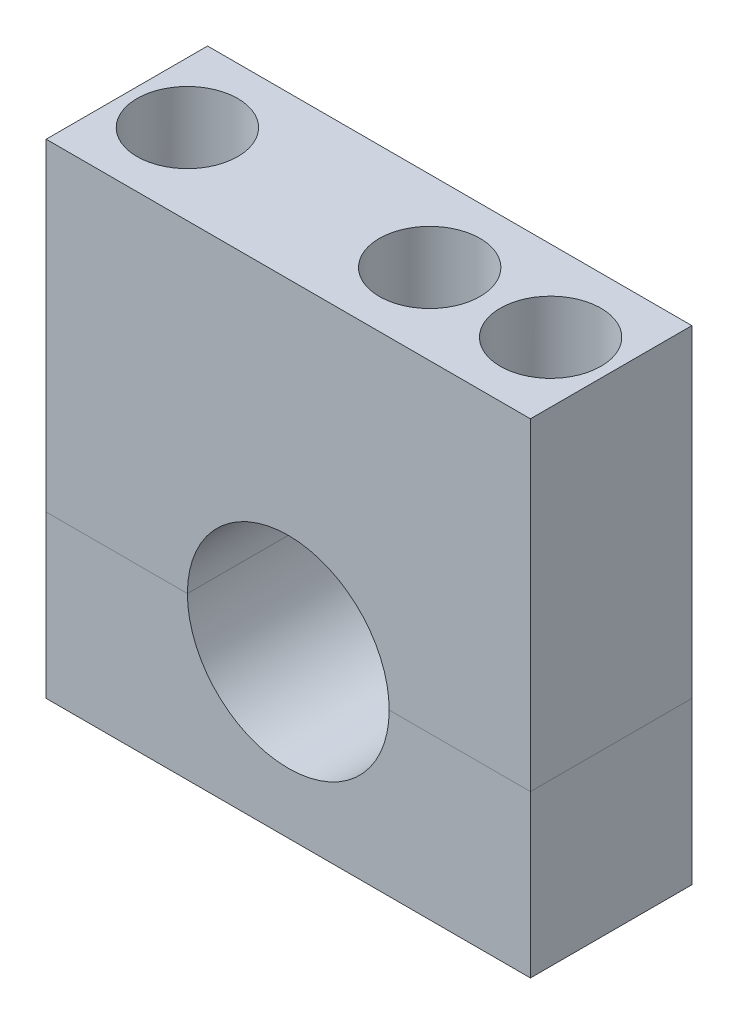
SolidWorks part; units mm, degrees
ref_plane "Front Plane" through (0, 0, 0) normal (0, 0, 1) x (1, 0, 0)
ref_plane "Top Plane" through (0, 0, 0) normal (0, 1, 0) x (1, 0, 0)
ref_plane "Right Plane" through (0, 0, 0) normal (1, 0, 0) x (0, 0, -1)
sketch "Sketch1" plane through (0, 0, 0) normal (0, 0, 1) x (1, 0, 0)
  line L0 (0, 0) -> (7.9375, 0) construction
  line L1 (0, 0) -> (0, 7.9375) construction
  line L2 (7.9375, 0) -> (19.05, 0)
  line L3 (19.05, 0) -> (19.05, 25.4)
  line L4 (19.05, 25.4) -> (-19.05, 25.4)
  line L5 (-19.05, 25.4) -> (-19.05, 0)
  line L6 (-19.05, 0) -> (-7.9375, 0)
  line L7 (19.05, 0) -> (19.05, -12.7)
  line L8 (19.05, -12.7) -> (-19.05, -12.7)
  line L9 (-19.05, -12.7) -> (-19.05, 0)
  line L10 (-14.2875, 25.4) -> (-14.2875, 0)
  line L11 (14.2875, 25.4) -> (14.2875, 0)
  line L12 (4.7752, 25.4) -> (4.7752, 16.4499) construction
  circle A0 centre (0, 0) radius 7.9375
  dimension "D1" = 15.875
  dimension "D2" = 38.1
  dimension "D4" = 25.4
  dimension "D5" = 12.7
  dimension "D6" = 28.575
  dimension "D7" = 4.7752
sketch "Sketch2" plane through (0, 0, 0) normal (0, 0, 1) x (1, 0, 0)
  line L0 (-19.05, 0) -> (-7.9375, 0) construction
  line L1 (7.9375, 0) -> (19.05, 0) construction
  line L2 (19.05, 0) -> (19.05, 25.4) construction
  line L3 (19.05, 25.4) -> (-19.05, 25.4) construction
  line L4 (-19.05, 25.4) -> (-19.05, 0) construction
  line L5 (-19.05, 0) -> (-7.9375, 0)
  line L6 (7.9375, 0) -> (19.05, 0)
  line L7 (19.05, 0) -> (19.05, 25.4)
  line L8 (19.05, 25.4) -> (-19.05, 25.4)
  line L9 (-19.05, 25.4) -> (-19.05, 0)
  circle A0 centre (0, 0) radius 7.9375 construction
  arc A1 (7.9375, 0) -> (-7.9375, 0) centre (0, 0) ccw
extrude "Boss-Extrude1" add sketch "Sketch2" along normal mid plane 12.7
sketch "Sketch3" plane through (0, 0, 0) normal (0, 0, 1) x (1, 0, 0)
  line L0 (-19.05, 0) -> (-7.9375, 0) construction
  line L1 (7.9375, 0) -> (19.05, 0) construction
  line L2 (19.05, 0) -> (19.05, -12.7) construction
  line L3 (19.05, -12.7) -> (-19.05, -12.7) construction
  line L4 (-19.05, -12.7) -> (-19.05, 0) construction
  line L5 (-19.05, 0) -> (-7.9375, 0)
  line L6 (7.9375, 0) -> (19.05, 0)
  line L7 (19.05, 0) -> (19.05, -12.7)
  line L8 (19.05, -12.7) -> (-19.05, -12.7)
  line L9 (-19.05, -12.7) -> (-19.05, 0)
  circle A0 centre (0, 0) radius 7.9375 construction
  arc A1 (-7.9375, 0) -> (7.9375, 0) centre (0, 0) ccw
extrude "Boss-Extrude2" add sketch "Sketch3" along normal mid plane 12.7 separate body
sketch "Sketch4" plane through (0, 0, 0) normal (0, 1, 0) x (1, 0, 0)
  circle A0 centre (-14.2875, 0) radius 2.3876
  circle A1 centre (-14.2875, 0) radius 3.9624
  circle A2 centre (14.2875, 0) radius 2.3876
  circle A3 centre (14.2875, 0) radius 3.9624
  dimension "D1" = 4.7752
  dimension "D2" = 7.9248
sketch "Sketch5" plane through (0, 0, 0) normal (0, 1, 0) x (1, 0, 0)
  circle A0 centre (-14.2875, 0) radius 2.3876 construction
  circle A1 centre (14.2875, 0) radius 2.3876 construction
  circle A2 centre (-14.2875, 0) radius 2.3876
  circle A3 centre (14.2875, 0) radius 2.3876
extrude "Cut-Extrude1" cut sketch "Sketch5" against normal blind 15.24 and the other way blind 50.8
sketch "Sketch6" plane through (0, 0, 0) normal (0, 1, 0) x (1, 0, 0)
  circle A0 centre (-14.2875, 0) radius 3.9624 construction
  circle A1 centre (14.2875, 0) radius 3.9624 construction
  circle A2 centre (-14.2875, 0) radius 3.9624
  circle A3 centre (14.2875, 0) radius 3.9624
extrude "Cut-Extrude2" cut sketch "Sketch6" along normal blind 27.94 from offset 5.08
sketch "Sketch7" plane through (0, 25.4, 0) normal (0, 1, 0) x (1, 0, 0)
  circle A0 centre (4.7752, 0) radius 3.9624
  dimension "D1" = 7.9248
extrude "Cut-Extrude3" cut sketch "Sketch7" against normal blind 15.875
